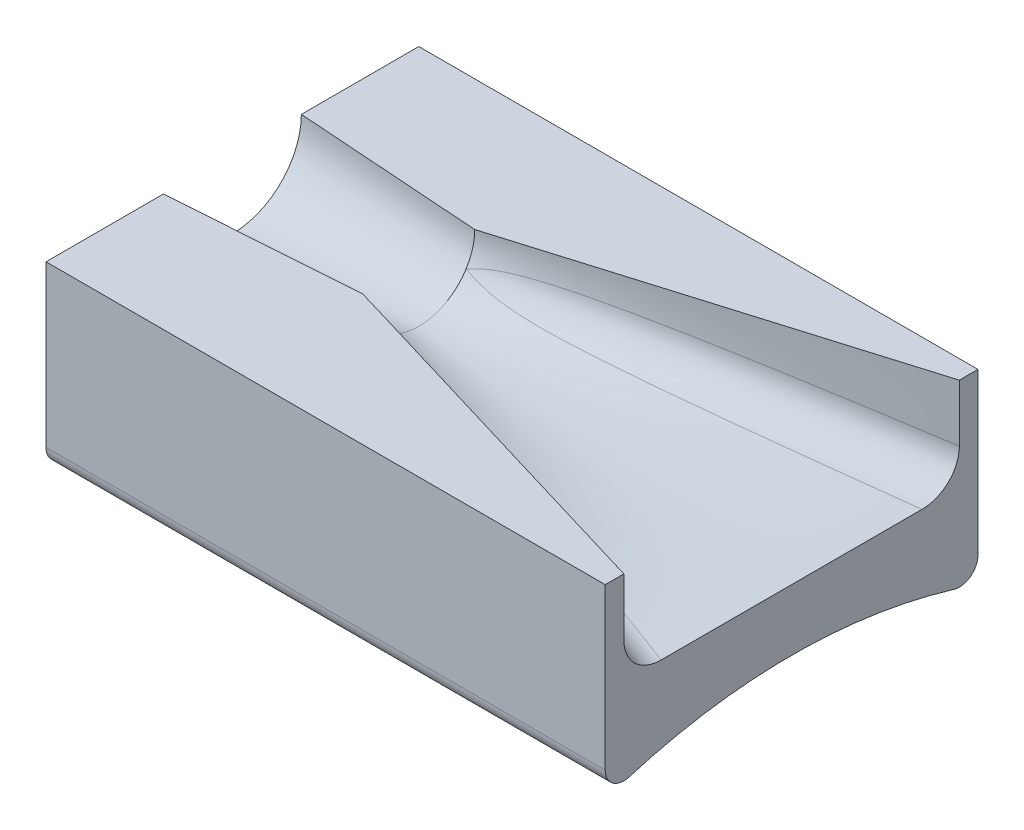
SolidWorks part; units mm, degrees
ref_plane "Front Plane" through (0, 0, 0) normal (0, 0, 1) x (1, 0, 0)
ref_plane "Top Plane" through (0, 0, 0) normal (0, 1, 0) x (1, 0, 0)
ref_plane "Right Plane" through (0, 0, 0) normal (1, 0, 0) x (0, 0, -1)
sketch "Sketch1" plane through (0, 0, 0) normal (1, 0, 0) x (0, 0, -1)
  line L0 (-50, 0) -> (50, 0) construction
  line L1 (-50, 6.9026) -> (-50, 50)
  line L2 (-50, 50) -> (50, 50)
  line L3 (50, 50) -> (50, 6.9026)
  arc A0 (-43.5484, 2.118) -> (43.5484, 2.118) centre (0, -141.4214) cw
  arc A1 (-43.5484, 2.118) -> (-50, 6.9026) centre (-45, 6.9026) cw
  arc A2 (43.5484, 2.118) -> (50, 6.9026) centre (45, 6.9026) ccw
  dimension "D1" = 150
  dimension "D4" = 5
  dimension "D2" = 100
  dimension "D3" = 50
extrude "Extrude1" add sketch "Sketch1" against normal blind 150
ref_plane "Plane1" through (-100, 0, 0) normal (1, 0, 0) x (0, 0, -1)
sketch "Sketch3" plane through (0, 0, 0) normal (1, 0, 0) x (0, 0, -1)
  line L0 (0, 8.5786) -> (0, 50) construction
  line L1 (50, 50) -> (-50, 50) construction
  line L2 (-45, 50) -> (45, 50)
  line L3 (45, 50) -> (45, 25)
  line L4 (45, 25) -> (-45, 25)
  line L5 (-45, 50) -> (-45, 25)
  arc A0 (43.5484, 2.118) -> (-43.5484, 2.118) centre (0, -141.4214) ccw construction
  point P15 (0, 25)
  dimension "D1" = 25
  dimension "D2" = 45
sketch "Sketch5" plane through (-100, 0, 0) normal (1, 0, 0) x (0, 0, -1)
  line L1 (-45, 50) -> (45, 50) construction
  line L2 (-15, 50) -> (15, 50)
  arc A0 (15, 50) -> (-15, 50) centre (0, 50) cw
  dimension "D1" = 15
sketch "Sketch7" plane through (0, 50, 0) normal (0, 1, 0) x (-1, 0, 0)
  line L0 (0, 0) -> (100, 0)
  line L1 (100, 15) -> (100, -15) construction
loft "Cut-Loft1" cut profiles "Sketch3", "Sketch5"
sketch "Sketch8" plane through (-100, 0, 0) normal (1, 0, 0) x (0, 0, -1)
  line L1 (15, 50) -> (-15, 50)
  line L2 (15, 50) -> (-15, 50)
  arc A3 (-15, 50) -> (-12.7009, 42.0195) centre (0, 50) ccw
  arc A4 (-12.7009, 42.0195) -> (12.7009, 42.0195) centre (0, 50) ccw
  arc A5 (12.7009, 42.0195) -> (15, 50) centre (0, 50) ccw
  arc A6 (-15, 50) -> (-12.7009, 42.0195) centre (0, 50) ccw
  arc A7 (-12.7009, 42.0195) -> (12.7009, 42.0195) centre (0, 50) ccw
  arc A8 (12.7009, 42.0195) -> (15, 50) centre (0, 50) ccw
  dimension "D1" = 0
extrude "Cut-Extrude1" cut sketch "Sketch8" against normal up to next draft 4
fillet "Fillet1" radius 10 2 edges
